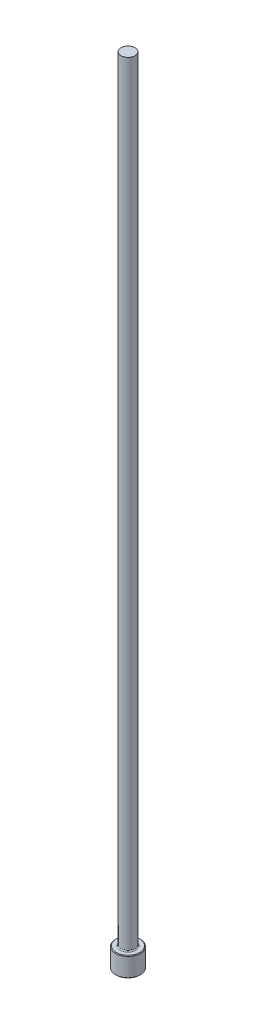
SolidWorks part; units mm, degrees
ref_plane "Front Plane" through (0, 0, 0) normal (0, 0, 1) x (1, 0, 0)
ref_plane "Top Plane" through (0, 0, 0) normal (0, 1, 0) x (1, 0, 0)
ref_plane "Right Plane" through (0, 0, 0) normal (1, 0, 0) x (0, 0, -1)
other "Configuration Table"
sketch "Sketch1" plane through (0, 0, 0) normal (0, 0, 1) x (1, 0, 0)
  line L0 (0, 259.9588) -> (0, -15.1925) construction
  line L1 (0, 0) -> (-0.9906, 0)
  line L2 (-0.9906, 0) -> (-0.9906, 1.5748)
  line L3 (-0.9906, 1.5748) -> (-0.5588, 1.5748)
  line L4 (-0.5588, 1.5748) -> (-0.5588, 63.5)
  line L5 (-0.5588, 63.5) -> (0, 63.5)
  line L6 (0, 63.5) -> (0, 0)
  dimension "L" = 63.5
  dimension "H" = 1.9812
  dimension "T" = 1.5748
  dimension "D" = 1.1176
revolve "Revolve1" add sketch "Sketch1" angle 360 about L0
chamfer "Chamfer1" distance 0.0508 angle 45 2 edges at (0, 1.5748, 0.9906) (0, 0, 0.9906)
fillet "Fillet1" radius 0.0762 1 edges at (0, 1.5748, 0.5588)
